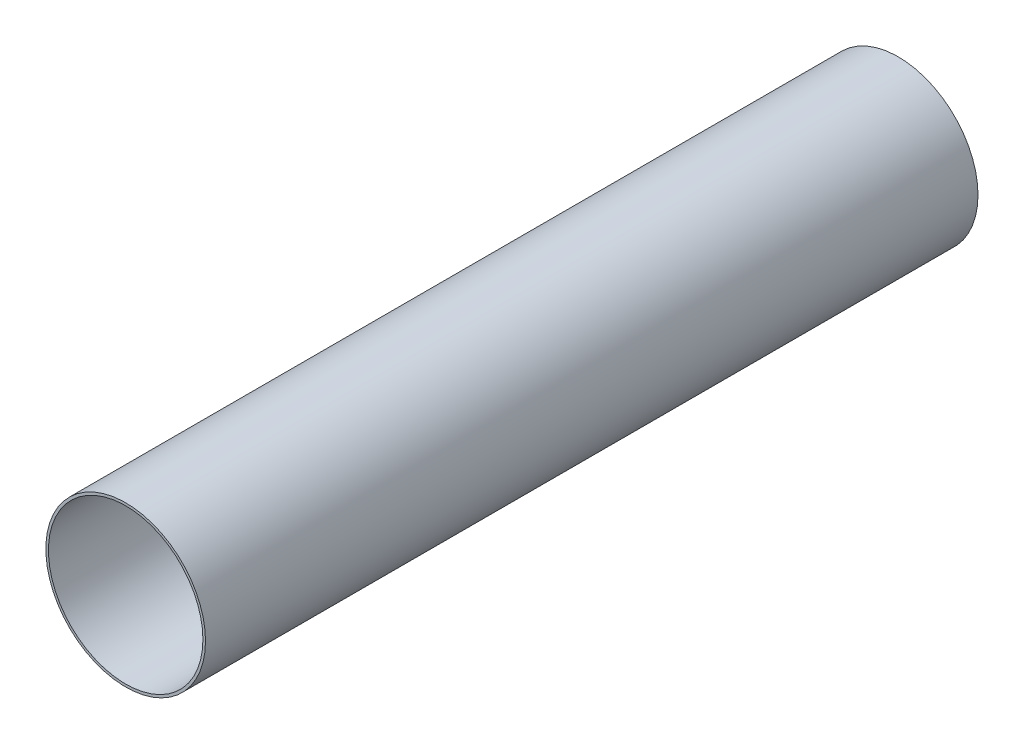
SolidWorks part; units mm, degrees
ref_plane "Plan de face" through (0, 0, 0) normal (0, 0, 1) x (1, 0, 0)
ref_plane "Plan de dessus" through (0, 0, 0) normal (0, 1, 0) x (1, 0, 0)
ref_plane "Plan de droite" through (0, 0, 0) normal (1, 0, 0) x (0, 0, -1)
sketch "Esquisse1" plane through (0, 0, 0) normal (0, 0, 1) x (1, 0, 0)
  circle A0 centre (0, 0) radius 1.5
  circle A1 centre (0, 0) radius 1.55
  dimension "D1" = 3
  dimension "D2" = 3.1
extrude "Extrusion1" add sketch "Esquisse1" along normal blind 15
